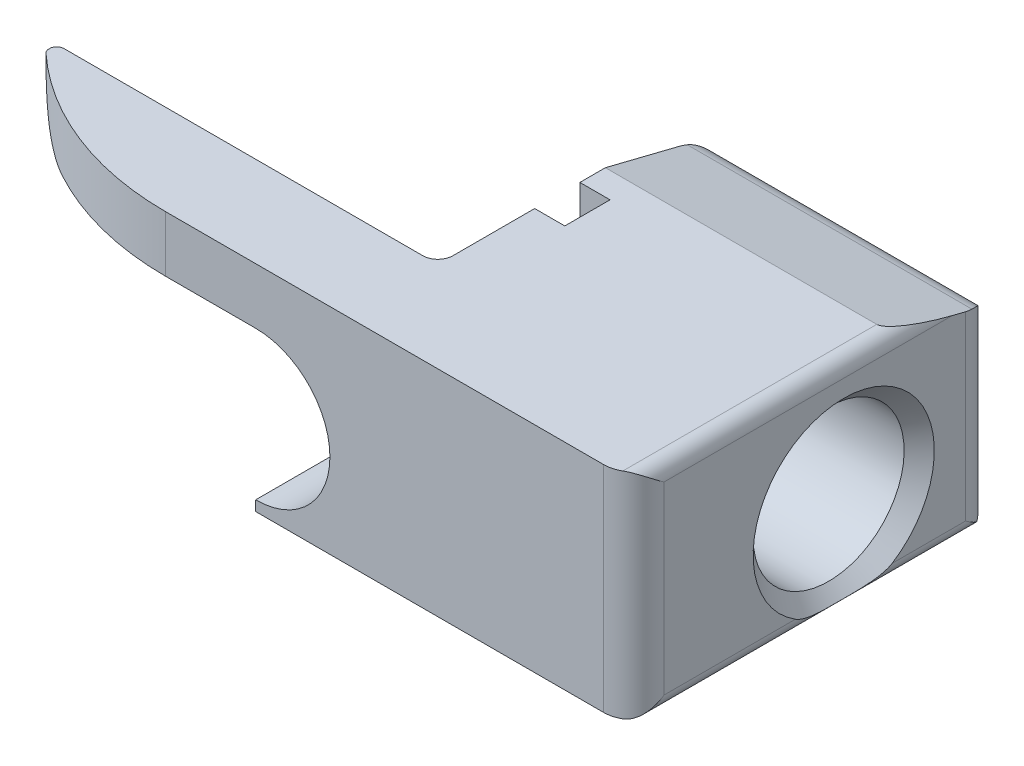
SolidWorks part; units mm, degrees
ref_plane "Спереди" through (0, 0, 0) normal (0, 0, 1) x (1, 0, 0)
ref_plane "Сверху" through (0, 0, 0) normal (0, 1, 0) x (1, 0, 0)
ref_plane "Справа" through (0, 0, 0) normal (1, 0, 0) x (0, 0, -1)
sketch "Эскиз1" plane through (0, 0, 0) normal (0, 1, 0) x (1, 0, 0)
  line L0 (-7.1438, -5.4927) -> (-7.1437, -1.1906)
  line L1 (-7.1437, -1.1906) -> (-5.5563, -1.1906)
  line L2 (-5.5563, -1.1906) -> (-5.5563, 1.1906)
  line L3 (-5.5563, 1.1906) -> (-7.1438, 1.1906)
  line L4 (-7.1438, 1.1906) -> (-7.1438, 6.4135)
  line L5 (-5.5562, 8.001) -> (6.35, 8.001)
  line L6 (7.9375, 6.4135) -> (7.9375, -9.4615)
  line L7 (6.35, -11.049) -> (-16.7142, -11.049)
  line L8 (-7.9375, -6.2865) -> (-26.817, -6.2865)
  line L9 (0, 0) -> (-34.2043, 0) construction
  arc A0 (-16.7142, -11.049) -> (-27.0871, -6.9741) centre (-16.7142, 4.191) cw
  arc A1 (7.9375, -9.4615) -> (6.35, -11.049) centre (6.35, -9.4615) cw
  arc A2 (6.35, 8.001) -> (7.9375, 6.4135) centre (6.35, 6.4135) cw
  arc A3 (-7.1438, 6.4135) -> (-5.5562, 8.001) centre (-5.5563, 6.4135) cw
  arc A4 (-27.0871, -6.9741) -> (-26.817, -6.2865) centre (-26.817, -6.6834) cw
  arc A5 (-7.1438, -5.4927) -> (-7.9375, -6.2865) centre (-7.9375, -5.4927) cw
  point P22 (-27.7812, -6.2865)
  dimension "D7" = 15.24
  dimension "D10" = 1.5875
  dimension "D11" = 0.3969
  dimension "D12" = 0.7937
  dimension "D1" = 2.3813
  dimension "D2" = 1.5875
  dimension "D3" = 7.9375
  dimension "D4" = 15.0812
  dimension "D5" = 19.05
  dimension "D6" = 11.049
  dimension "D8" = 4.7625
  dimension "D9" = 35.7188
extrude "Бобышка-Вытянуть1" add sketch "Эскиз1" along normal mid plane 11.303
sketch "Эскиз2" plane through (0, 0, 11.049) normal (0, 0, 1) x (1, 0, 0)
  line L0 (-27.2139, 5.8801) -> (-27.2139, -5.6515)
  line L1 (-27.2139, -5.6515) -> (-11.9761, -5.6515)
  line L2 (-16.7142, -5.6515) -> (6.35, -5.6515) construction
  line L3 (-11.9761, -5.6515) -> (-11.9761, -5.1181)
  line L4 (-11.9761, 2.7051) -> (-24.0389, 2.7051)
  line L5 (-27.2139, 5.6515) -> (-27.2139, -5.6515) construction
  line L6 (7.9375, 5.6515) -> (7.9375, -5.6515) construction
  line L7 (7.1437, 5.6515) -> (7.9375, 5.6515)
  line L8 (-16.7142, 5.6515) -> (6.35, 5.6515) construction
  line L9 (7.9375, 4.8578) -> (7.9375, 5.6515)
  line L10 (7.1437, -5.6515) -> (7.9375, -5.6515)
  line L11 (7.9375, -4.8578) -> (7.9375, -5.6515)
  arc A0 (-24.0389, 2.7051) -> (-27.2139, 5.8801) centre (-24.0389, 5.8801) cw
  arc A1 (-11.9761, -5.1181) -> (-11.9761, 2.7051) centre (-11.9761, -1.2065) ccw
  arc A2 (7.1437, -5.6515) -> (7.9375, -4.8578) centre (7.1437, -4.8578) ccw
  arc A3 (7.9375, 4.8578) -> (7.1437, 5.6515) centre (7.1437, 4.8578) ccw
  point P12 (-8.0645, -1.2065)
  dimension "D1" = 3.9116
  dimension "D4" = 3.175
  dimension "D5" = 0.7937
  dimension "D2" = 4.445
  dimension "D3" = 16.002
extrude "Вырез-Вытянуть1" cut sketch "Эскиз2" against normal through all
sketch "Эскиз3" plane through (7.9375, 0, 0) normal (1, 0, 0) x (0, 0, -1)
  line L0 (2.5313, 5.6515) -> (6.7976, 4.5878)
  line L2 (2.5313, 5.6515) -> (8.001, 5.6515)
  line L3 (8.001, 5.6515) -> (8.001, 3.0475)
  line L4 (8.001, 5.6515) -> (8.001, -5.6515) construction
  line L5 (-10.8363, -5.6515) -> (7.7883, -5.6515) construction
  line L6 (-10.8363, 5.6515) -> (7.7883, 5.6515) construction
  line L7 (6.4135, -5.6515) -> (8.001, -5.6515)
  line L8 (8.001, -5.6515) -> (8.001, -4.064)
  circle A0 centre (0, -0.8255) radius 3.9751
  arc A1 (8.001, 3.0475) -> (6.7976, 4.5878) centre (6.4135, 3.0475) ccw
  arc A2 (8.001, -4.064) -> (6.4135, -5.6515) centre (6.4135, -4.064) cw
  dimension "D1" = 7.9502
  dimension "D4" = 1.5875
  dimension "D5" = 1.5875
  dimension "D2" = 14
  dimension "D3" = 6.096
  dimension "D6" = 4.826
extrude "Вырез-Вытянуть2" cut sketch "Эскиз3" against normal through all
chamfer "Фаска1" distance 0.7937 angle 45 1 edges at (7.9375, -0.8255, -3.9751)
